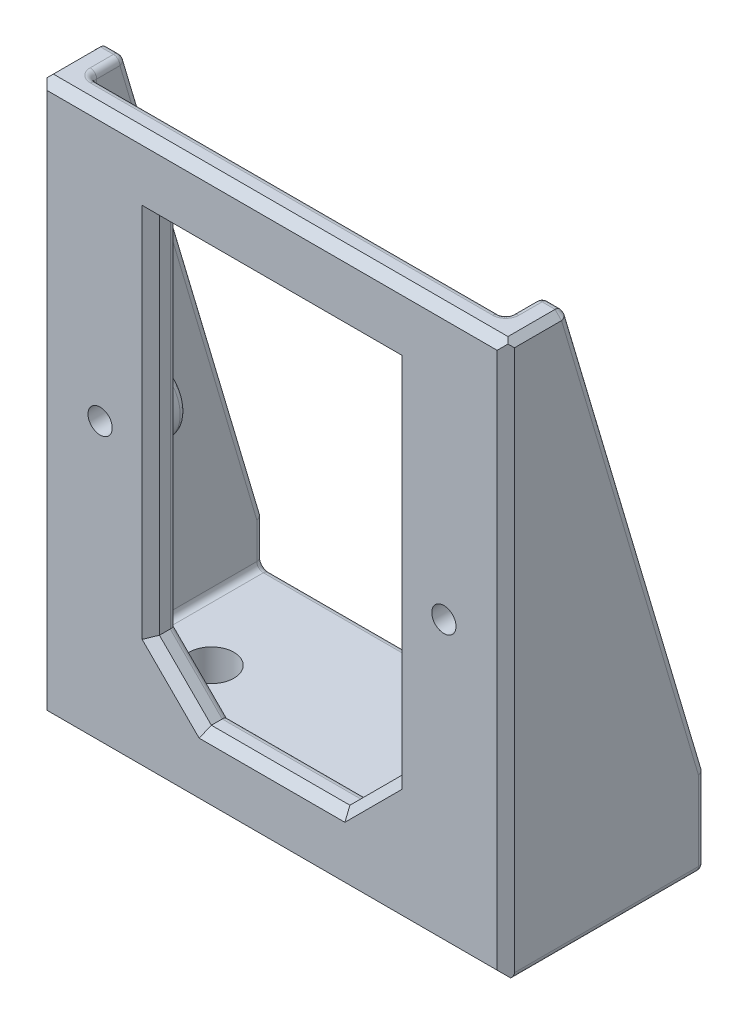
SolidWorks part; units mm, degrees
ref_plane "Front Plane" through (0, 0, 0) normal (0, 0, 1) x (1, 0, 0)
ref_plane "Top Plane" through (0, 0, 0) normal (0, 1, 0) x (1, 0, 0)
ref_plane "Right Plane" through (0, 0, 0) normal (1, 0, 0) x (0, 0, -1)
sketch "Sketch1" plane through (0, 0, 0) normal (0, 0, 1) x (1, 0, 0)
  line L0 (-27, 0) -> (27, 0)
  line L1 (27, 0) -> (27, 64)
  line L2 (27, 64) -> (-27, 64)
  line L3 (-27, 64) -> (-27, 0)
  line L4 (0, 64) -> (0, 0) construction
  line L5 (-8, 8) -> (8, 8)
  line L6 (8, 8) -> (14, 14)
  line L7 (14, 14) -> (14, 56)
  line L8 (14, 56) -> (-14, 56)
  line L9 (-14, 56) -> (-14, 14)
  line L10 (-14, 14) -> (-8, 8)
  line L11 (-26, 33) -> (26, 33) construction
  line L12 (0, 56) -> (0, 8) construction
  circle A0 centre (-19.85, 33) radius 1.4
  circle A1 centre (19.85, 33) radius 1.4
  point P2 (0, 0)
  point P10 (0, 8)
  point P11 (0, 56)
  dimension "D7" = 2.8
  dimension "D8" = 39.7
  dimension "D9" = 33
  dimension "D1" = 54
  dimension "D2" = 64
  dimension "D3" = 48
  dimension "D4" = 16
  dimension "D5" = 28
  dimension "D6" = 6
  dimension "D10" = 23
extrude "Boss-Extrude1" add sketch "Sketch1" along normal blind 3
sketch "Sketch2" plane through (27, 0, 0) normal (1, 0, 0) x (0, 0, -1)
  line L0 (0, 64) -> (0, 0)
  line L1 (0, 0) -> (20, 0)
  line L2 (-3, 0) -> (-3, 64) construction
  line L4 (20, 0) -> (20, 10)
  line L5 (4, 64) -> (20, 10)
  line L7 (4, 64) -> (0, 64)
  dimension "D1" = 23
  dimension "D3" = 10
  dimension "D4" = 4
extrude "Boss-Extrude2" add sketch "Sketch2" against normal blind 3
mirror "Mirror1" about plane through (0, 0, 0) normal (1, 0, 0) of "Boss-Extrude2"
sketch "Sketch3" plane through (0, 0, 0) normal (0, 0, -1) x (-1, 0, 0)
  line L0 (-19.85, 37) -> (-24, 37)
  line L1 (-24, 64) -> (-24, 0) construction
  line L2 (-19.85, 29) -> (-24, 29)
  line L3 (-24, 29) -> (-24, 37)
  line L4 (0, 64) -> (0, 0) construction
  line L5 (-24, 64) -> (24, 64) construction
  line L6 (24, 29) -> (24, 37)
  line L7 (19.85, 29) -> (24, 29)
  line L8 (19.85, 37) -> (24, 37)
  arc A0 (-19.85, 29) -> (-19.85, 37) centre (-19.85, 33) ccw
  arc A1 (19.85, 29) -> (19.85, 37) centre (19.85, 33) cw
  dimension "D1" = 8
extrude "Boss-Extrude3" add sketch "Sketch3" along normal blind 3
sketch "Sketch4" plane through (0, 0, 0) normal (0, 0, 1) x (1, 0, 0)
  circle A0 centre (-19.85, 33) radius 1.4 construction
  circle A1 centre (19.85, 33) radius 1.4 construction
  circle A2 centre (-19.85, 33) radius 1.4
  circle A3 centre (19.85, 33) radius 1.4
extrude "Cut-Extrude2" cut sketch "Sketch4" against normal up to surface (3 mm away)
sketch "Sketch5" plane through (0, 0, 0) normal (0, -1, 0) x (1, 0, 0)
  line L0 (-24, 0) -> (-24, -20)
  line L1 (-24, 0) -> (24, 0)
  line L2 (24, 0) -> (24, -20)
  line L3 (24, 0) -> (24, -20) construction
  line L4 (-24, -20) -> (24, -20)
  line L5 (24, -7) -> (-24, -7) construction
  line L6 (-27, 3) -> (27, 3) construction
  circle A0 centre (-17, -7) radius 2.6
  circle A1 centre (17, -7) radius 2.6
  dimension "D2" = 5.2
  dimension "D3" = 7
  dimension "D4" = 7
  dimension "D1" = 10
extrude "Boss-Extrude4" add sketch "Sketch5" against normal blind 5
fillet "Fillet3" radius 0.75 49 edges at (-24, 7.5, -20) (24, 7.5, -20) (24, 5, -10) (0, 5, -20) (-24, 5, -10) (-11, 11, 0) (0, 8, 0) (11, 11, 0) (14, 35, 0) (0, 56, 0) (-14, 35, 0) (24, 37, -12) (25.5, 64, -4) (25.5, 10, -20) (0, 0, -20) (27, 5, -20) (27, 37, -12) (-25.5, 64, -4) (-27, 5, -20) (-27, 37, -12) (-25.5, 10, -20) (-24, 64, -2) (-24, 50.5, 0) (-24, 37, -12) (27, 0, -8.5) (-27, 0, -8.5) (15.85, 33, 0) (21.925, 37, 0) (24, 37, -1.5) (21.925, 29, 0) (24, 29, -1.5) (15.85, 33, -3) (21.925, 37, -3) (24, 33, -3) (21.925, 29, -3) (-24, 17, 0) (-15.85, 33, 0) (-21.925, 29, 0) (-24, 29, -1.5) (-21.925, 37, 0) (-24, 37, -1.5) (-15.85, 33, -3) (-21.925, 29, -3) (-24, 33, -3) (-21.925, 37, -3)
chamfer "Chamfer1" distance 1 angle 45 12 edges at (0, 56, 3) (14, 35, 3) (11, 11, 3) (0, 8, 3) (-11, 11, 3) (-14, 35, 3) (0, 64, 3) (-27, 32.375, 3) (27, 32.375, 3) (-26.7803, 0.2197, 3) (26.7803, 0.2197, 3) (0, 0, 3)
chamfer "Chamfer2" distance 1 angle 45 2 edges at (-27, 32, 3) (27, 32, 3)
chamfer "Chamfer3" distance 0.75 angle 45 4 edges at (26.6987, 63.851, -3.8887) (27, 64, -0.6089) (-26.6987, 63.851, -3.8887) (-27, 64, -0.6089)
